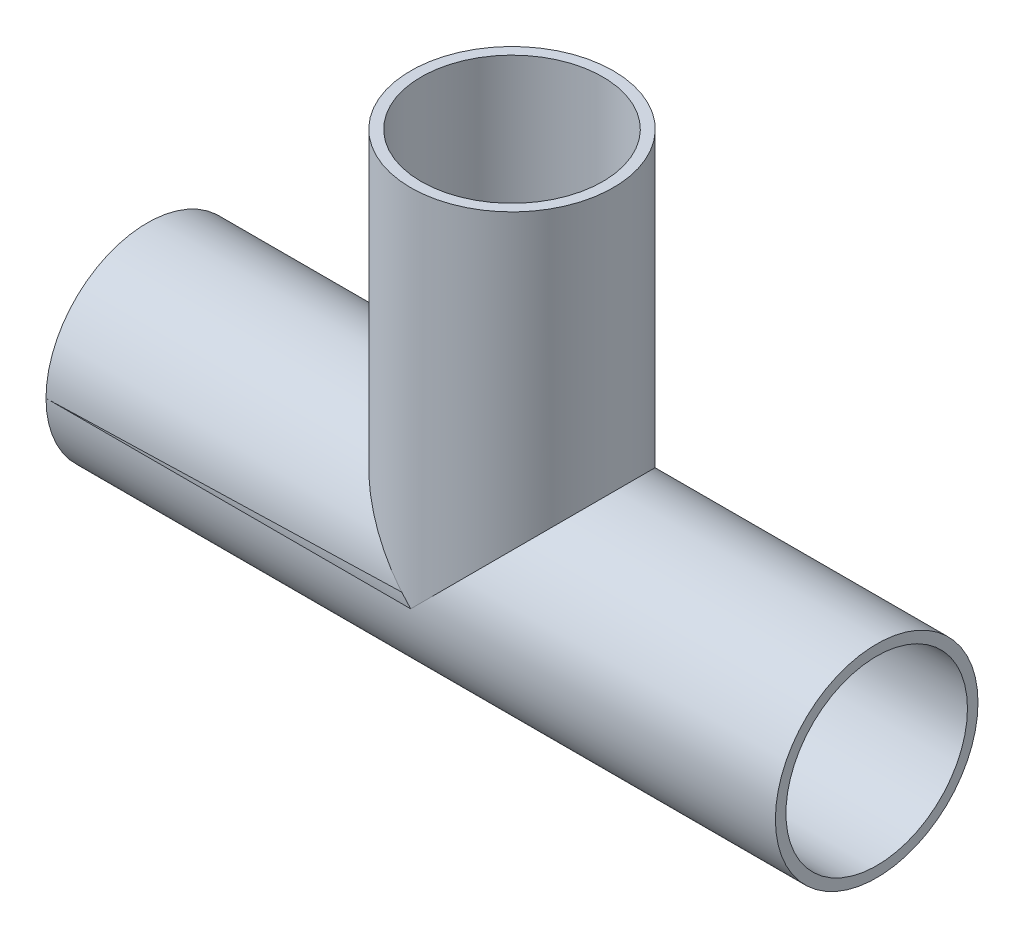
SolidWorks part; units mm, degrees
ref_plane "Front Plane" through (0, 0, 0) normal (0, 0, 1) x (1, 0, 0)
ref_plane "Top Plane" through (0, 0, 0) normal (0, 1, 0) x (1, 0, 0)
ref_plane "Right Plane" through (0, 0, 0) normal (1, 0, 0) x (0, 0, -1)
sketch "Sketch1" plane through (0, 0, 0) normal (0, 1, 0) x (1, 0, 0)
  circle A0 centre (0, 0) radius 15.875
extrude "Boss-Extrude1" add sketch "Sketch1" along normal blind 57.15
sketch "Sketch2" plane through (0, 0, 0) normal (1, 0, 0) x (0, 0, -1)
  circle A0 centre (0, 0) radius 15.875
extrude "Boss-Extrude2" add sketch "Sketch2" along normal mid plane 114.3
sketch "Sketch3" plane through (0, 57.15, 0) normal (0, 1, 0) x (1, 0, 0)
  circle A0 centre (0, 0) radius 14.224
extrude "Cut-Extrude1" cut sketch "Sketch3" against normal blind 57.15
sketch "Sketch4" plane through (57.15, 0, 0) normal (1, 0, 0) x (0, 0, -1)
  circle A0 centre (0, 0) radius 14.224
extrude "Cut-Extrude2" cut sketch "Sketch4" against normal through all
